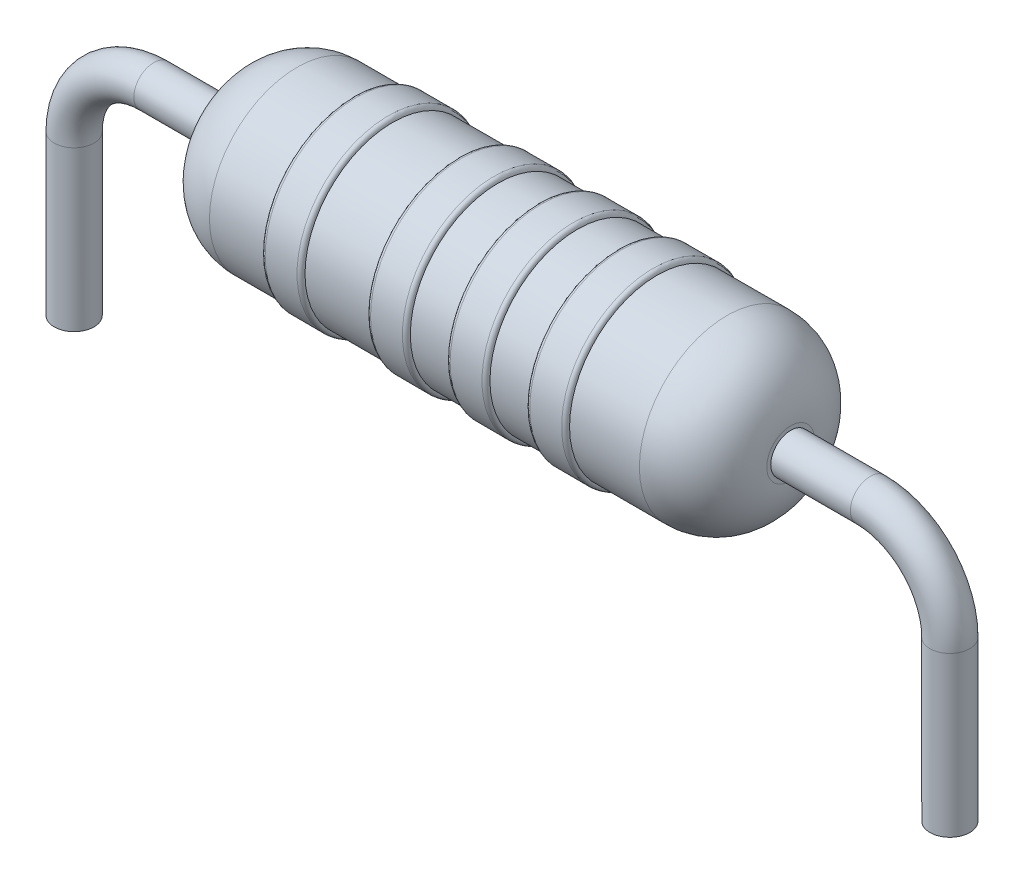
SolidWorks part; units mm, degrees
ref_plane "Face" through (0, 0, 0) normal (0, 0, 1) x (1, 0, 0)
ref_plane "Dessus" through (0, 0, 0) normal (0, 1, 0) x (1, 0, 0)
ref_plane "Droite" through (0, 0, 0) normal (1, 0, 0) x (0, 0, -1)
sketch "Esquisse1" plane through (0, 0, 0) normal (0, 0, 1) x (1, 0, 0)
  line L0 (-54.2687, 0) -> (62.1733, 0) construction
  line L1 (-48.4922, 1.1) -> (45.7559, 1.1) construction
  line L2 (-3.5, -1.6411) -> (-3.5, 4.3175) construction
  line L3 (0, -1.0268) -> (0, 4.1947) construction
  line L4 (3.5, 3.6009) -> (3.5, -1.9687) construction
  line L5 (-3.5, 0) -> (-3.5, 0.3)
  line L6 (-2.7, 1.1) -> (2.7, 1.1)
  line L7 (3.5, 0.3) -> (3.5, 0)
  line L8 (3.5, 0) -> (-3.5, 0)
  arc A0 (-2.7, 1.1) -> (-3.5, 0.3) centre (-2.7, 0.3) ccw
  arc A1 (3.5, 0.3) -> (2.7, 1.1) centre (2.7, 0.3) ccw
revolve "Base-Révolution" add sketch "Esquisse1" angle 360 about L0
sketch "Esquisse2" plane through (0, 0, 0) normal (0, 0, 1) x (1, 0, 0)
  line L0 (-3.3896, 1.15) -> (3.161, 1.15) construction
  line L1 (-2, 1.3889) -> (-2, -0.1179) construction
  line L2 (-1.5, 1.4925) -> (-1.5, -0.2136) construction
  line L3 (4.3262, 0) -> (-3.8651, 0) construction
  line L4 (1.323, 0) -> (1.823, 0)
  line L5 (0.323, 0) -> (0.823, 0)
  line L6 (-0.677, 1.15) -> (-0.677, 0)
  line L7 (0.323, 1.15) -> (0.323, 0)
  line L8 (1.323, 1.15) -> (1.323, 0)
  line L9 (-0.177, 1.15) -> (-0.177, 0)
  line L10 (0.823, 1.15) -> (0.823, 0)
  line L11 (1.823, 1.15) -> (1.823, 0)
  line L12 (-0.677, 0) -> (-0.177, 0)
  line L13 (-0.677, 1.15) -> (-0.177, 1.15)
  line L14 (0.323, 1.15) -> (0.823, 1.15)
  line L15 (1.323, 1.15) -> (1.823, 1.15)
  line L16 (-2, 1.15) -> (-1.5, 1.15)
  line L17 (-1.5, 1.15) -> (-1.5, 0)
  line L18 (-1.5, 0) -> (-2, 0)
  line L19 (-2, 0) -> (-2, 1.15)
revolve "Boss.-Révol.1" add sketch "Esquisse2" angle 360 about L3
fillet "Congé1" radius 0.05 8 edges at (-0.177, 0, -1.15) (-0.677, 0, -1.15) (0.823, 0, -1.15) (0.323, 0, -1.15) (1.823, 0, -1.15) (1.323, 0, -1.15) (-1.5, 0, -1.15) (-2, 0, -1.15)
sketch "Esquisse3" plane through (-3.5, 0, 0) normal (-1, 0, 0) x (0, 0, 1)
  circle A0 centre (0, 0) radius 0.25
sketch "Esquisse4" plane through (0, 0, 0) normal (0, 0, 1) x (1, 0, 0)
  line L0 (-3.1075, 0) -> (-5.8186, 0) construction
  line L1 (0, -2.524) -> (0, 3.2043) construction
  line L2 (-5.9326, -3) -> (3.6667, -3) construction
  line L3 (-5.5, 1.6795) -> (-5.5, -3.4934) construction
  line L4 (-3.5, 0) -> (-4.5, 0)
  line L5 (-5.5, -1) -> (-5.5, -3)
  arc A0 (-4.5, 0) -> (-5.5, -1) centre (-4.5, -1) ccw
  dimension "D3" = 1
  dimension "D1" = 3
  dimension "D2" = 5.5
sweep "Balayage1" add profiles "Esquisse3" path "Esquisse4"
ref_plane "Plan1" through (0, 0, 0) normal (1, 0, 0) x (0, 0, -1)
mirror "Symétrie1" about plane through (0, 0, 0) normal (1, 0, 0) of "Balayage1"
